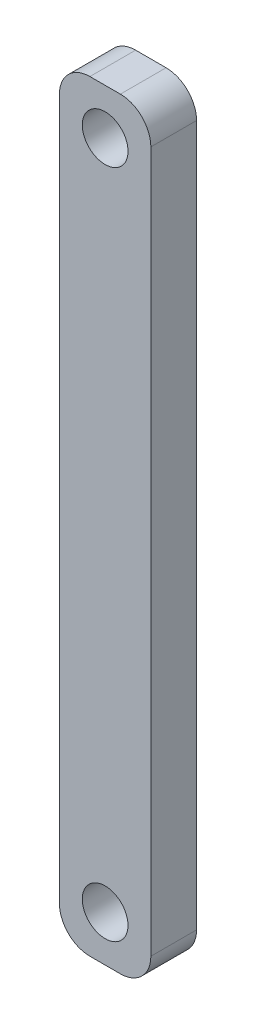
SolidWorks part; units mm, degrees
ref_plane "前视基准面" through (0, 0, 0) normal (0, 0, 1) x (1, 0, 0)
ref_plane "上视基准面" through (0, 0, 0) normal (0, 1, 0) x (1, 0, 0)
ref_plane "右视基准面" through (0, 0, 0) normal (1, 0, 0) x (0, 0, -1)
sketch "草图1" plane through (0, 0, 0) normal (0, 0, 1) x (1, 0, 0)
  line L0 (0, 0) -> (6, 0)
  line L1 (6, 0) -> (6, -50)
  line L2 (6, -50) -> (0, -50)
  line L3 (0, -50) -> (0, 0)
  circle A0 centre (3, -3) radius 1.5
  circle A1 centre (3, -47) radius 1.5
  dimension "D3" = 3
  dimension "D4" = 3
  dimension "D5" = 3
  dimension "D6" = 3
  dimension "D7" = 3
  dimension "D8" = 3
  dimension "D1" = 50
  dimension "D2" = 6
extrude "凸台-拉伸1" add sketch "草图1" along normal blind 3
fillet "圆角1" radius 2 4 edges at (6, -50, 1.5) (0, -50, 1.5) (0, 0, 1.5) (6, 0, 1.5)
